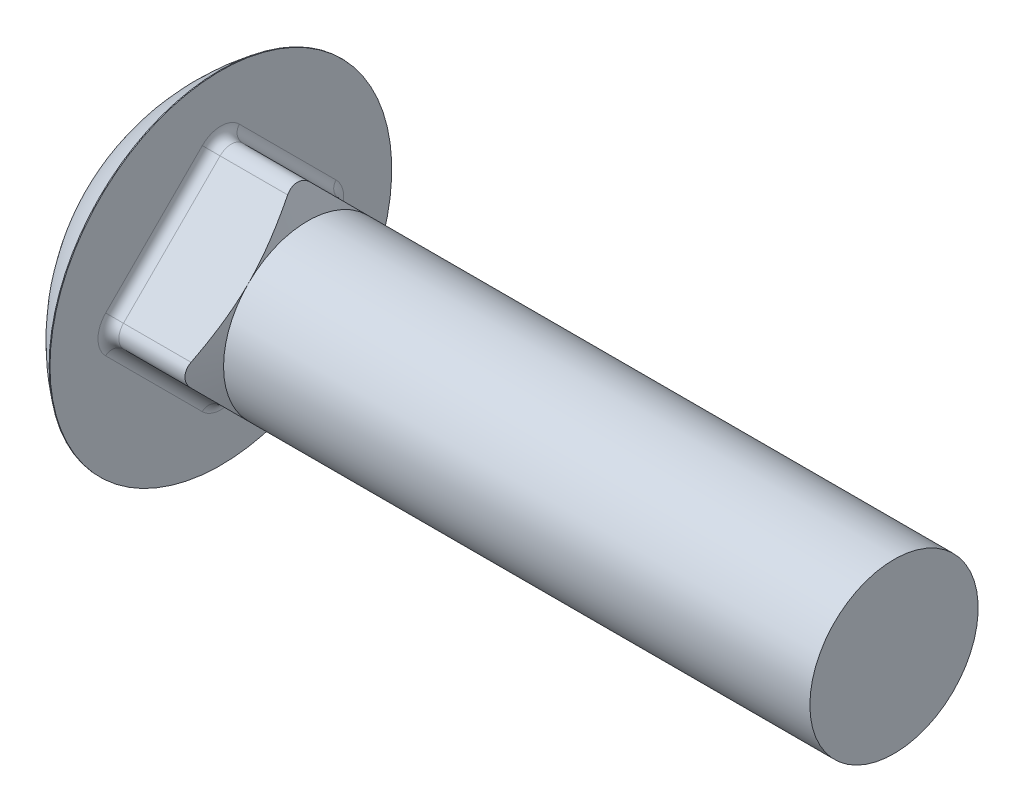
SolidWorks part; units mm, degrees
ref_plane "Plane1" through (0, 0, 0) normal (0, 0, 1) x (1, 0, 0)
ref_plane "Plane2" through (0, 0, 0) normal (0, 1, 0) x (1, 0, 0)
ref_plane "Plane3" through (0, 0, 0) normal (1, 0, 0) x (0, 0, -1)
sketch "BodySke" plane through (0, 0, 0) normal (0, 0, 1) x (1, 0, 0)
  line L0 (0, 0) -> (114.7064, 0)
  line L1 (13.1064, 12.7) -> (114.7064, 12.7)
  line L2 (13.1064, -12.7) -> (114.7064, -12.7) construction
  line L3 (114.7064, 12.7) -> (114.7064, 0)
  line L4 (13.1064, 25.7937) -> (12.9794, 25.7937)
  line L5 (13.1064, -25.7937) -> (12.9794, -25.7937) construction
  line L6 (0, 0) -> (123.825, 0) construction
  line L8 (13.1064, 25.7937) -> (13.1064, 12.7)
  arc A0 (12.9794, 25.7937) -> (0, 0) centre (32.1194, 0) ccw
  point P11 (13.1064, 12.7)
  dimension "D1" = 0.127
  dimension "Diameter" = 25.4
  dimension "Length" = 101.6
  dimension "Head_dia" = 51.5874
  dimension "Head_ht" = 13.1064
revolve "Base-Revolve" add sketch "BodySke"
revolve "ThreadSchematic" cut sketch "ThdSchSke" angle 360 about L6
sketch "ThdSchSke" plane through (0, 0, 0) normal (0, 0, 1) x (1, 0, 0)
  line L0 (92.075, -10.8077) -> (90.75, -12.7)
  line L1 (92.075, -10.8077) -> (93.4, -12.7)
  line L2 (93.4, -12.7) -> (93.4, -15.875)
  line L3 (-3.175, 0) -> (5.1513, 0) construction
  line L5 (93.4, -15.875) -> (90.75, -15.875)
  line L6 (90.75, -15.875) -> (90.75, -12.7)
  point P6 (0, 0)
  dimension "D1" = 360
  dimension "Thread_minor" = 21.6154
  dimension "Diameter" = 25.4
  dimension "Start" = 92.075
  dimension "SideAngle" = 55
  dimension "VeeAngle" = 70
  dimension "Overcut" = 31.75
  dimension "Thread_length" = 22.6314
sketch "Sketch2" plane through (13.1064, 0, 0) normal (1, 0, 0) x (0, -0.7071, -0.7071)
  line L1 (10.3124, -12.7) -> (-10.3124, -12.7)
  line L2 (12.7, -10.3124) -> (12.7, 10.3124)
  line L3 (10.3124, 12.7) -> (-10.3124, 12.7)
  line L4 (-12.7, -10.3124) -> (-12.7, 10.3124)
  arc A0 (-12.7, 10.3124) -> (-10.3124, 12.7) centre (-10.3124, 10.3124) cw
  arc A1 (12.7, 10.3124) -> (10.3124, 12.7) centre (10.3124, 10.3124) ccw
  arc A2 (10.3124, -12.7) -> (12.7, -10.3124) centre (10.3124, -10.3124) ccw
  arc A3 (-12.7, -10.3124) -> (-10.3124, -12.7) centre (-10.3124, -10.3124) ccw
  dimension "Neck_corner_radius" = 2.3876
  dimension "D1" = 12.7
  dimension "Neck_width" = 25.4
  dimension "D2" = 25.4
  dimension "D3" = 12.7
extrude "Neck" add sketch "Sketch2" along normal blind 13.1064
fillet "NeckFillet" radius 1.5748 8 edges at (13.1064, 8.9803, -8.9803) (13.1064, -8.9803, -8.9803) (13.1064, -8.9803, 8.9803) (13.1064, 8.9803, 8.9803) (13.1064, 16.9715, 0) (13.1064, 0, 16.9715) (13.1064, -16.9715, 0) (13.1064, 0, -16.9715)
sketch "Sketch3" plane through (0, 0, 0) normal (0, 0, 1) x (1, 0, 0)
  line L0 (26.2128, 12.7) -> (16.8247, 38.4937)
  line L1 (28.321, 19.05) -> (28.321, -15.875) construction
  line L2 (16.8247, 38.4937) -> (38.9128, 38.4937)
  line L3 (38.9128, 38.4937) -> (38.9128, 12.7)
  line L4 (26.2128, 12.7) -> (38.9128, 12.7)
  line L5 (0, 0) -> (57.7043, 0) construction
  line L6 (26.2128, 0) -> (14.6812, 0) construction
  line L7 (92.075, 22.225) -> (92.075, -19.05) construction
  line L11 (114.7064, -12.7) -> (114.7064, 12.7) construction
  dimension "D1" = 12.7
  dimension "D2" = 26.2128
  dimension "D3" = 110
  dimension "D4" = 12.7
  dimension "D5" = 38.4937
  dimension "Advance" = 2.1082
  dimension "Thread_nom" = 22.6314
revolve "Cut-Revolve1" cut sketch "Sketch3" angle 360 about L5
pattern_linear "ThdSchPat" [suppressed]
equation "\"D1@Sketch2\" = \"Neck_width@Sketch2\" / 2"
equation "\"D2@Sketch2\" = \"Neck_width@Sketch2\""
equation "\"D3@Sketch2\" = \"D2@Sketch2\" / 2"
equation "\"D1@Sketch3\" = \"Diameter@BodySke\"/2"
equation "\"D2@Sketch3\" = \"Head_ht@BodySke\"+\"Neck_ht@Neck\""
equation "\"D5@Sketch3\" = \"Head_dia@BodySke\"/2+.5"
equation "\"Thread_length@ThreadCosmetic\" = ((sgn( (\"Length@BodySke\" - \"Advance@Sketch3\" - \"Neck_ht@Neck\" ) - \"Thread_nom@Sketch3\" )-1)*( (\"Length@BodySke\" - \"Advance@Sketch3\" - \"Neck_ht@Neck\" ) - \"Thread_nom@Sk"
equation "\"Thread_minor@ThdSchSke\" = \"Thread_minor@ThreadCosmetic\""
equation "\"Diameter@ThdSchSke\" = \"Diameter@BodySke\""
equation "\"Overcut@ThdSchSke\" = \"Diameter@BodySke\" * 1.25"
equation "\"Start@ThdSchSke\" = \"Head_ht@BodySke\" + \"Length@BodySke\" - \"Thread_length@ThreadCosmetic\"  '---Non-countersunk---"
equation "\"Num_threads@ThdSchPat\" = int( \"Thread_length@ThreadCosmetic\" / \"Advance@Sketch3\" + 0.999 )  + 1"
equation "\"Advance@ThdSchPat\" = \"Thread_length@ThreadCosmetic\" /  (\"Num_threads@ThdSchPat\" - 1) 'relax it"
